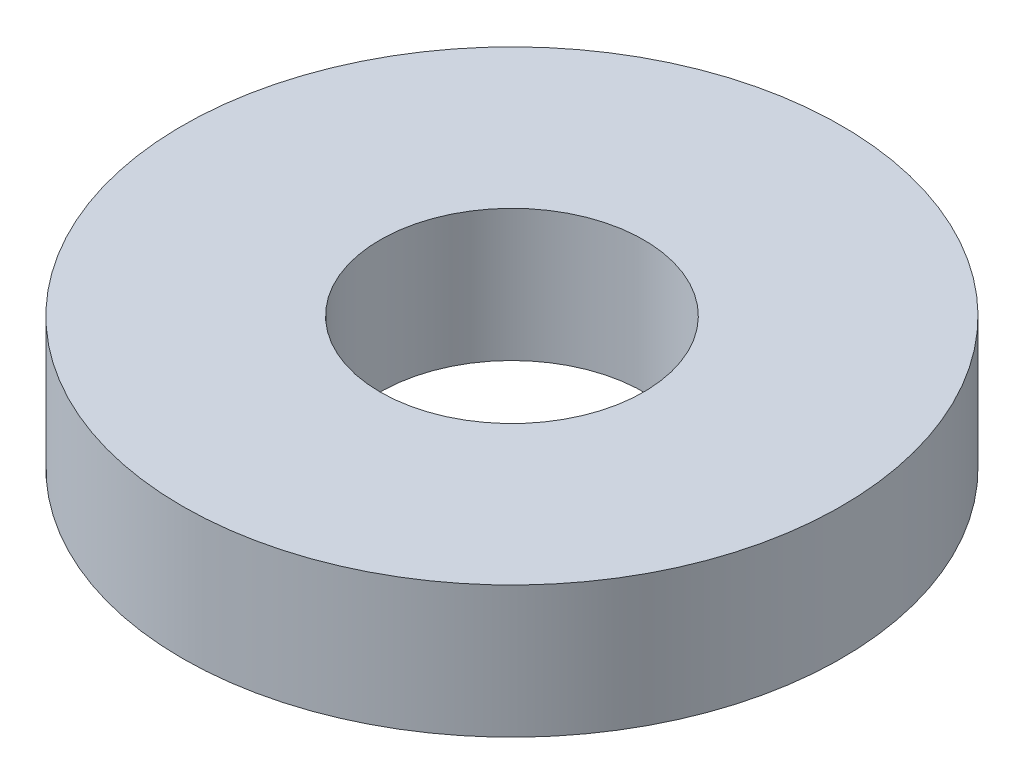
SolidWorks part; units mm, degrees
ref_plane "Plan de face" through (0, 0, 0) normal (0, 0, 1) x (1, 0, 0)
ref_plane "Plan de dessus" through (0, 0, 0) normal (0, 1, 0) x (1, 0, 0)
ref_plane "Plan de droite" through (0, 0, 0) normal (1, 0, 0) x (0, 0, -1)
sketch "Esquisse1" plane through (0, 0, 0) normal (0, 1, 0) x (1, 0, 0)
  circle A0 centre (0, 0) radius 7.5
  circle A1 centre (0, 0) radius 3
  dimension "D1" = 15
  dimension "D2" = 6
extrude "Extrusion1" add sketch "Esquisse1" along normal blind 3
